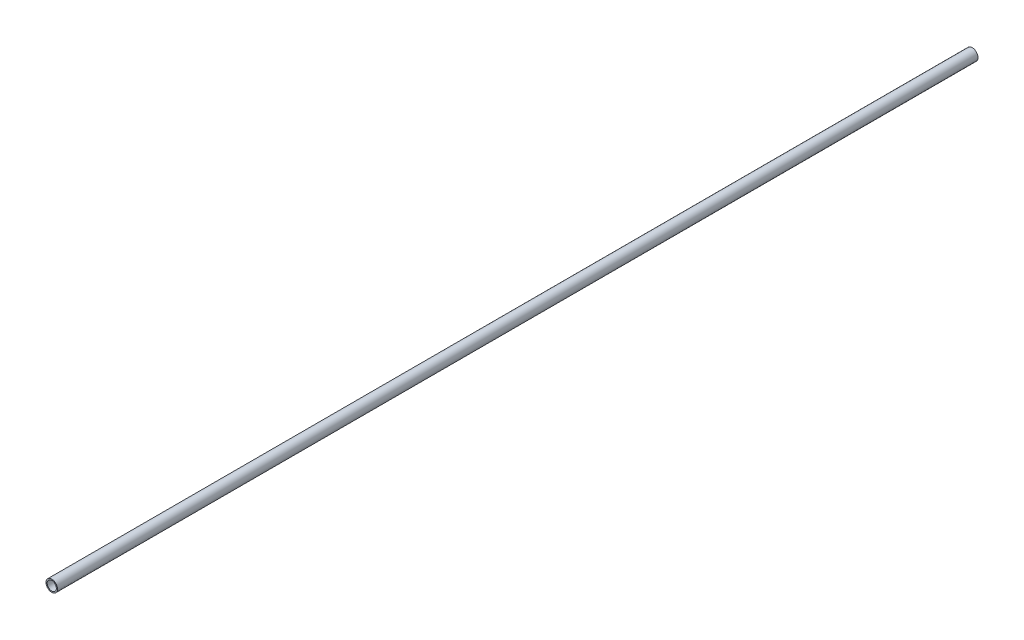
SolidWorks part; units mm, degrees
ref_plane "Спереди" through (0, 0, 0) normal (0, 0, 1) x (1, 0, 0)
ref_plane "Сверху" through (0, 0, 0) normal (0, 1, 0) x (1, 0, 0)
ref_plane "Справа" through (0, 0, 0) normal (1, 0, 0) x (0, 0, -1)
sketch "Эскиз1" plane through (0, 0, 0) normal (0, 0, 1) x (1, 0, 0)
  line L0 (-98.3008, 0) -> (106.0202, 0) construction
  line L1 (0, 92.9938) -> (0, -58.9805) construction
  circle A0 centre (0, 0) radius 5
  dimension "D1" = 10
extrude "Вытянуть-Тонкостенный1" add sketch "Эскиз1" along normal blind 800 thin
